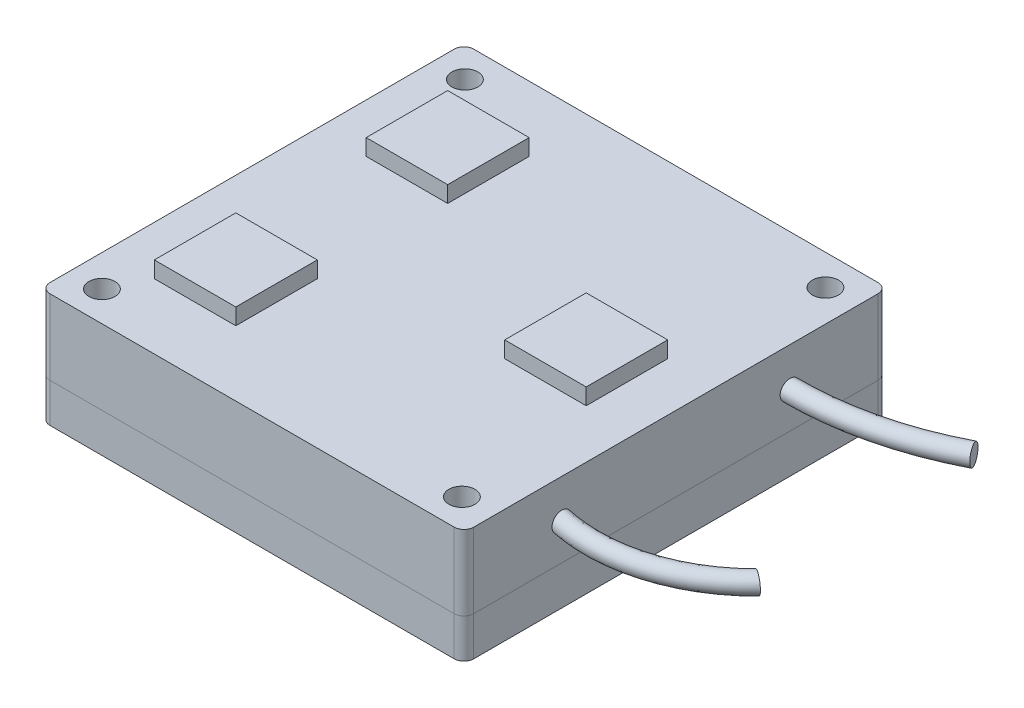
SolidWorks part; units mm, degrees
ref_plane "Plan de face" through (0, 0, 0) normal (0, 0, 1) x (1, 0, 0)
ref_plane "Plan de dessus" through (0, 0, 0) normal (0, 1, 0) x (1, 0, 0)
ref_plane "Plan de droite" through (0, 0, 0) normal (1, 0, 0) x (0, 0, -1)
sketch "Esquisse1" plane through (0, 0, 0) normal (0, 1, 0) x (1, 0, 0)
  line L2 (0, 0) -> (130, 0)
  line L3 (0, 0) -> (0, -130)
  line L4 (0, -130) -> (130, -130)
  line L5 (130, 0) -> (130, -130)
  dimension "D1" = 130
  dimension "D2" = 130
extrude "Extrusion1" add sketch "Esquisse1" along normal blind 23
fillet "Congé1" radius 3 4 edges at (0, 11.5, 0) (0, 11.5, 130) (130, 11.5, 0) (130, 11.5, 130)
sketch "Esquisse2" plane through (0, 0, 0) normal (0, -1, 0) x (1, 0, 0)
  line L0 (19.5, 4) -> (110.5, 4)
  line L1 (112.5, 6) -> (112.5, 14.5)
  line L2 (115.5, 17.5) -> (124, 17.5)
  line L3 (126, 19.5) -> (126, 110.5)
  line L4 (124, 112.5) -> (115.5, 112.5)
  line L5 (112.5, 115.5) -> (112.5, 124)
  line L6 (110.5, 126) -> (19.5, 126)
  line L7 (17.5, 124) -> (17.5, 115.5)
  line L8 (14.5, 112.5) -> (6, 112.5)
  line L9 (4, 110.5) -> (4, 19.5)
  line L10 (6, 17.5) -> (14.5, 17.5)
  line L11 (17.5, 14.5) -> (17.5, 6)
  line L12 (127, 0) -> (3, 0) construction
  line L13 (0, 3) -> (0, 127) construction
  line L14 (3, 130) -> (127, 130) construction
  line L15 (130, 127) -> (130, 3) construction
  arc A0 (112.5, 14.5) -> (115.5, 17.5) centre (115.5, 14.5) cw
  arc A1 (14.5, 17.5) -> (17.5, 14.5) centre (14.5, 14.5) cw
  arc A2 (17.5, 115.5) -> (14.5, 112.5) centre (14.5, 115.5) cw
  arc A3 (115.5, 112.5) -> (112.5, 115.5) centre (115.5, 115.5) cw
  arc A4 (110.5, 4) -> (112.5, 6) centre (110.5, 6) ccw
  arc A5 (124, 17.5) -> (126, 19.5) centre (124, 19.5) ccw
  arc A6 (126, 110.5) -> (124, 112.5) centre (124, 110.5) ccw
  arc A7 (112.5, 124) -> (110.5, 126) centre (110.5, 124) ccw
  arc A8 (6, 112.5) -> (4, 110.5) centre (6, 110.5) ccw
  arc A9 (19.5, 126) -> (17.5, 124) centre (19.5, 124) ccw
  arc A10 (4, 19.5) -> (6, 17.5) centre (6, 19.5) ccw
  arc A11 (19.5, 4) -> (17.5, 6) centre (19.5, 6) cw
  point P30 (112.5, 4)
  point P33 (126, 17.5)
  point P36 (126, 112.5)
  point P39 (112.5, 126)
  point P42 (4, 112.5)
  point P45 (17.5, 126)
  point P48 (4, 17.5)
  point P51 (17.5, 4)
  dimension "D13" = 3
  dimension "D14" = 2
  dimension "D1" = 4
  dimension "D2" = 4
  dimension "D3" = 4
  dimension "D4" = 4
  dimension "D5" = 95
  dimension "D6" = 95
  dimension "D7" = 95
  dimension "D8" = 95
  dimension "D9" = 17.5
  dimension "D10" = 17.5
  dimension "D11" = 17.5
  dimension "D12" = 17.5
extrude "Extrusion2" cut sketch "Esquisse2" against normal blind 18
sketch "Esquisse3" plane through (0, 0, 0) normal (0, -1, 0) x (1, 0, 0)
  circle A0 centre (9.6931, 9.4114) radius 4
  arc A1 (17.5, 14.5) -> (14.5, 17.5) centre (14.5, 14.5) ccw construction
  circle A2 centre (120.2998, 9.4047) radius 4
  arc A3 (115.5, 17.5) -> (112.5, 14.5) centre (115.5, 14.5) ccw construction
  circle A4 centre (120.1202, 120.7587) radius 4
  arc A5 (112.5, 115.5) -> (115.5, 112.5) centre (115.5, 115.5) ccw construction
  circle A6 centre (9.6931, 120.7587) radius 4
  dimension "D1" = 7
  dimension "D2" = 7
  dimension "D3" = 7
extrude "Extrusion3" cut sketch "Esquisse3" against normal blind 23
sketch "Esquisse6" plane through (0, 18, 0) normal (0, -1, 0) x (1, 0, 0)
  line L0 (110.5, 126) -> (19.5, 126) construction
  line L1 (126, 19.5) -> (126, 110.5) construction
  circle A0 centre (103.5, 111) radius 5
  circle A1 centre (63.5, 111) radius 5
  circle A2 centre (23.5, 111) radius 5
  circle A3 centre (103.5, 66) radius 5
  circle A6 centre (103.5, 21) radius 5
  circle A7 centre (63.5, 21) radius 5
  circle A8 centre (23.5, 21) radius 5
  circle A9 centre (23.5, 66) radius 5
  circle A10 centre (63.5, 66) radius 5
  dimension "D1" = 15
  dimension "D2" = 22.5
extrude "Extrusion6" cut sketch "Esquisse6" against normal blind 1.5
sketch "Esquisse7" plane through (0, 19.5, 0) normal (0, -1, 0) x (1, 0, 0)
  circle A0 centre (103.5, 111) radius 3
  circle A1 centre (63.5, 111) radius 3
  circle A2 centre (23.5, 111) radius 3
  circle A3 centre (103.5, 66) radius 3
  circle A6 centre (103.5, 21) radius 3
  circle A7 centre (63.5, 21) radius 3
  circle A8 centre (23.5, 21) radius 3
  circle A9 centre (63.5, 66) radius 3
  circle A10 centre (23.5, 66) radius 3
extrude "Extrusion7" add sketch "Esquisse7" along normal blind 6.5
sketch "Esquisse8" plane through (0, 13, 0) normal (0, -1, 0) x (1, 0, 0)
  circle A0 centre (63.5, 111) radius 1
  circle A1 centre (103.5, 111) radius 1
  circle A3 centre (103.5, 66) radius 1
  circle A4 centre (63.5, 21) radius 1
  circle A5 centre (103.5, 21) radius 1
  circle A6 centre (23.5, 111) radius 1
  circle A7 centre (23.5, 21) radius 1
  circle A8 centre (63.5, 66) radius 1
extrude "Extrusion8" cut sketch "Esquisse8" against normal blind 3
fillet "Congé2" radius 1 14 edges at (23.5, 13, 108) (23.5, 13, 110) (103.5, 13, 110) (103.5, 13, 108) (63.5, 13, 108) (63.5, 13, 110) (103.5, 13, 65) (103.5, 13, 63) (63.5, 13, 18) (103.5, 13, 18) (103.5, 13, 20) (63.5, 13, 20) (23.5, 13, 18) (23.5, 13, 20)
sketch "Esquisse9" plane through (0, 0, 0) normal (-1, 0, 0) x (0, 0, 1)
  line L0 (130, 23) -> (130, 0) construction
  line L3 (3, 0) -> (127, 0) construction
  line L4 (72, 11) -> (100, 11) construction
  circle A0 centre (100, 11) radius 6.5
  circle A1 centre (72, 11) radius 6.5
  dimension "D1" = 13
  dimension "D2" = 11
  dimension "D3" = 30
  dimension "D4" = 28
extrude "Extrusion9" cut sketch "Esquisse9" against normal blind 5
sketch "Esquisse11" plane through (0, 0, 0) normal (0, -1, 0) x (1, 0, 0)
  line L4 (0, 127) -> (0, 3)
  line L5 (3, 0) -> (127, 0)
  line L6 (130, 3) -> (130, 127)
  line L7 (127, 130) -> (3, 130)
  line L8 (0, 127) -> (0, 3)
  line L9 (3, 0) -> (127, 0)
  line L10 (130, 3) -> (130, 127)
  line L11 (127, 130) -> (3, 130)
  arc A4 (0, 3) -> (3, 0) centre (3, 3) ccw
  arc A5 (127, 0) -> (130, 3) centre (127, 3) ccw
  arc A6 (130, 127) -> (127, 130) centre (127, 127) ccw
  arc A7 (3, 130) -> (0, 127) centre (3, 127) ccw
  arc A8 (0, 3) -> (3, 0) centre (3, 3) ccw
  arc A9 (127, 0) -> (130, 3) centre (127, 3) ccw
  arc A10 (130, 127) -> (127, 130) centre (127, 127) ccw
  arc A11 (3, 130) -> (0, 127) centre (3, 127) ccw
  dimension "D1" = 0
extrude "Extrusion11" add sketch "Esquisse11" along normal blind 12 separate body
ref_plane "Plan1" through (0, 11, 0) normal (0, 1, 0) x (-1, 0, 0)
sketch "Esquisse13" plane through (130, 0, 0) normal (1, 0, 0) x (0, 0, -1)
  line L0 (71.5, 11) -> (-71.5, 11) construction
  line L2 (-65, 23) -> (-65, -12) construction
  line L3 (-127, 23) -> (-3, 23) construction
  line L4 (-3, -12) -> (-127, -12) construction
  circle A1 centre (-30, 11) radius 3
  dimension "D1" = 6
  dimension "D2" = 35
sketch "Esquisse14" plane through (130, 0, 0) normal (1, 0, 0) x (0, 0, -1)
  line L0 (-65, 23) -> (-65, -12) construction
  line L1 (71.5, 11) -> (-71.5, 11) construction
  circle A0 centre (-100, 11) radius 3
  circle A1 centre (-30, 11) radius 3 construction
  dimension "D1" = 35
sketch "Esquisse12" plane through (0, 11, 0) normal (0, 1, 0) x (-1, 0, 0)
  arc A0 (-130, 30) -> (-175.4718, 19.0275) centre (-130.4904, -67.675) ccw
sketch "Esquisse15" plane through (0, 11, 0) normal (0, 1, 0) x (-1, 0, 0)
  arc A0 (-130, 100) -> (-176.207, 86.1766) centre (-140.4977, 50.9513) ccw
sweep "Balayage3" add profiles "Esquisse14" path "Esquisse15"
sketch "Esquisse16" plane through (0, 23, 0) normal (0, 1, 0) x (-1, 0, 0)
  line L0 (0, 3) -> (0, 127) construction
  line L1 (-15, 20) -> (-40, 20)
  line L2 (-15, 20) -> (-15, 45)
  line L3 (-15, 45) -> (-40, 45)
  line L4 (-40, 20) -> (-40, 45)
  line L5 (-15, 20) -> (-40, 45) construction
  line L6 (-15, 45) -> (-40, 20) construction
  line L7 (-15, 85) -> (-40, 85)
  line L8 (-15, 85) -> (-15, 110)
  line L9 (-15, 110) -> (-40, 110)
  line L10 (-40, 85) -> (-40, 110)
  line L11 (-15, 85) -> (-40, 110) construction
  line L12 (-15, 110) -> (-40, 85) construction
  line L13 (-90, 52.5) -> (-115, 52.5)
  line L14 (-90, 52.5) -> (-90, 77.5)
  line L15 (-90, 77.5) -> (-115, 77.5)
  line L16 (-115, 52.5) -> (-115, 77.5)
  line L17 (-90, 52.5) -> (-115, 77.5) construction
  line L18 (-90, 77.5) -> (-115, 52.5) construction
  line L19 (-130, 127) -> (-130, 3) construction
  line L20 (-27.5, 45) -> (-27.5, 85) construction
  line L22 (-27.5, 65) -> (-90, 65) construction
  line L23 (-115, 65) -> (-130, 65) construction
  point P0 (-27.5, 32.5)
  point P5 (-27.5, 97.5)
  point P10 (-102.5, 65)
  dimension "D1" = 25
  dimension "D2" = 15
  dimension "D3" = 15
  dimension "D4" = 40
extrude "Extrusion12" add sketch "Esquisse16" along normal blind 5
sweep "Balayage4" add profiles "Esquisse13" path "Esquisse12"
